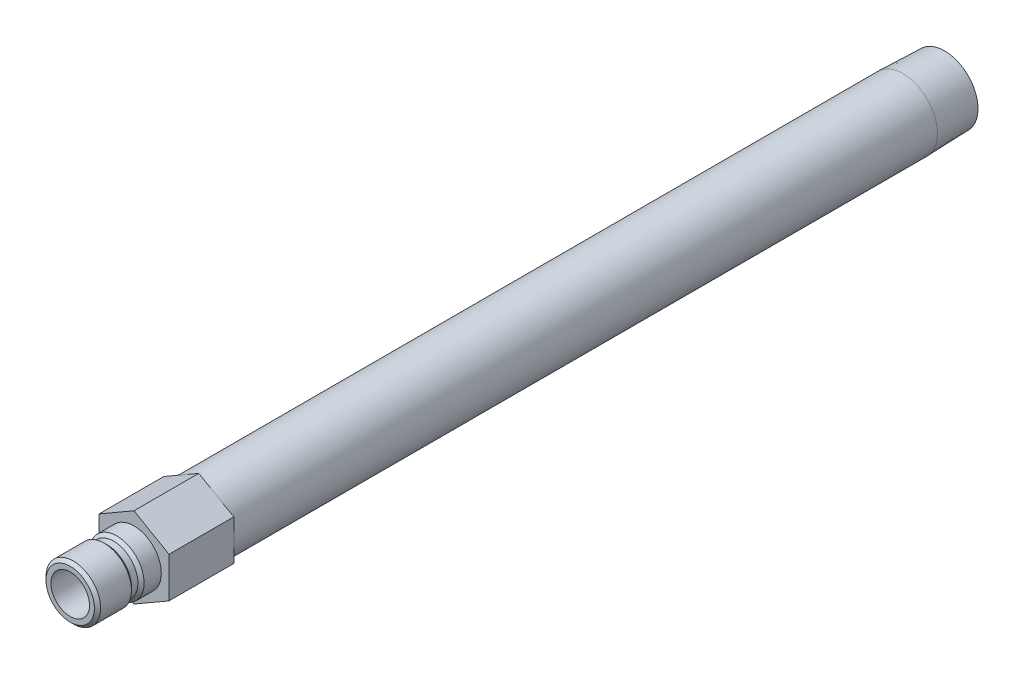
SolidWorks part; units mm, degrees
ref_plane "Front Plane" through (0, 0, 0) normal (0, 0, 1) x (1, 0, 0)
ref_plane "Top Plane" through (0, 0, 0) normal (0, 1, 0) x (1, 0, 0)
ref_plane "Right Plane" through (0, 0, 0) normal (1, 0, 0) x (0, 0, -1)
sketch "Sketch1" plane through (0, 0, 0) normal (1, 0, 0) x (0, 0, -1)
  line L0 (0, 0) -> (-18.923, 0) construction
  line L1 (-15.748, 4.7625) -> (-15.748, 5.9817)
  line L2 (-6.604, 5.9817) -> (-6.604, 0) construction
  line L3 (-14.986, 6.7437) -> (-7.366, 6.7437)
  line L4 (0, 8.5725) -> (0, 0) construction
  line L5 (-6.604, 5.9817) -> (-5.0165, 5.9817)
  line L6 (-4.2545, 6.7437) -> (0, 6.7437)
  line L7 (0, 6.7437) -> (0, 8.5725)
  line L8 (-6.604, 5.9817) -> (-7.366, 6.7437)
  line L9 (-5.0165, 5.9817) -> (-4.2545, 6.7437)
  line L10 (-15.748, 5.9817) -> (-14.986, 6.7437)
  line L11 (-15.748, 4.7625) -> (16.002, 4.7625)
  line L12 (0, 8.5725) -> (189.8142, 8.5725)
  line L13 (189.8142, 8.5725) -> (200.152, 8.2494)
  line L14 (200.152, 8.2494) -> (200.152, 6.2611)
  line L15 (0, 6.7437) -> (16.002, 6.7437) construction
  line L16 (16.002, 6.7437) -> (16.002, 0) construction
  line L17 (16.002, 0) -> (0, 0) construction
  line L18 (16.002, 4.7625) -> (16.002, 6.2611)
  line L19 (16.002, 6.2611) -> (200.152, 6.2611)
  dimension "D1" = 15.748
  dimension "D2" = 1.5875
  dimension "D3" = 0.762
  dimension "D4" = 45
  dimension "D5" = 9.144
  dimension "D6" = 45
  dimension "D7" = 1.79
  dimension "D8" = 10.3378
  dimension "D9" = 215.9
  dimension "D10" = 3.175
  dimension "D11" = 9.525
  dimension "D12" = 17.145
  dimension "D13" = 31.75
  dimension "D14" = 13.4874
  dimension "D15" = 12.5222
revolve "Revolve1" add sketch "Sketch1" angle 360 about L0
sketch "Sketch2" plane through (0, 0, 0) normal (0, 0, 1) x (1, 0, 0)
  line L1 (-8.636, 4.986) -> (-8.636, -4.986)
  line L2 (-8.636, -4.986) -> (0, -9.972)
  line L3 (0, -9.972) -> (8.636, -4.986)
  line L4 (8.636, -4.986) -> (8.636, 4.986)
  line L5 (8.636, 4.986) -> (0, 9.972)
  line L6 (0, 9.972) -> (-8.636, 4.986)
  circle A0 centre (0, 0) radius 8.636 construction
  circle A1 centre (0, 0) radius 4.7625 construction
  circle A2 centre (0, 0) radius 4.7625
  dimension "D1" = 17.272
extrude "Boss-Extrude1" add sketch "Sketch2" against normal up to vertex (16.002 mm away) from vertex at 0
